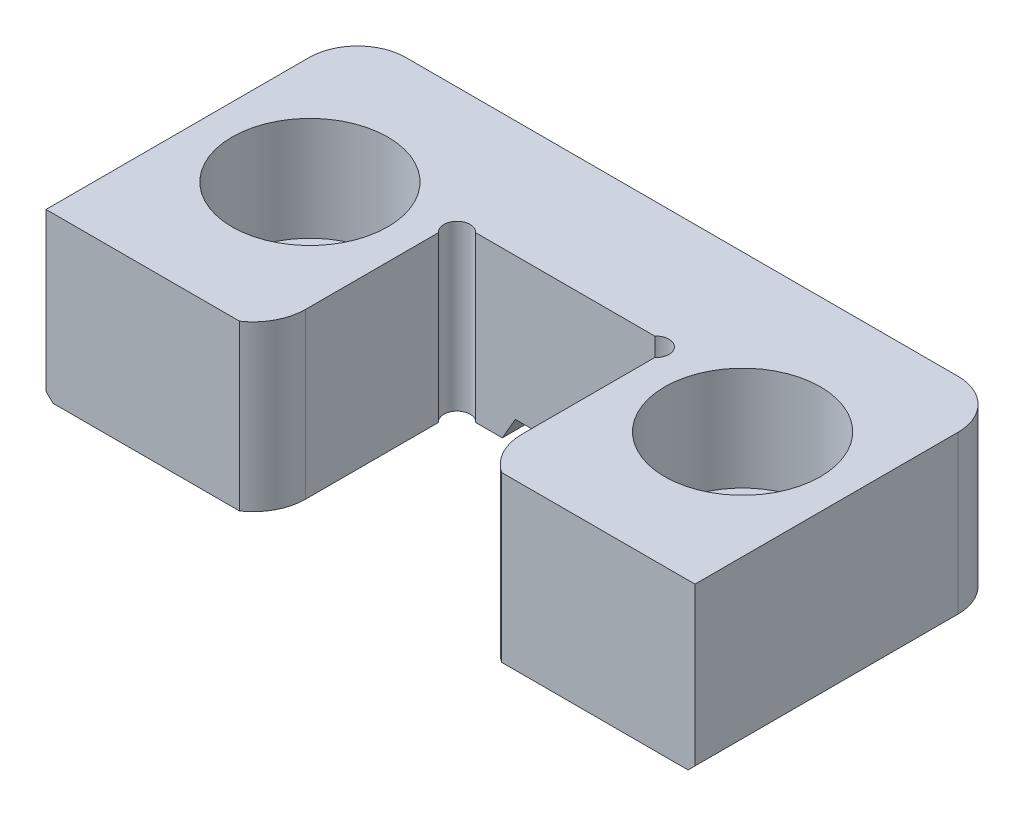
SolidWorks part; units mm, degrees
ref_plane "Front Plane" through (0, 0, 0) normal (0, 0, 1) x (1, 0, 0)
ref_plane "Top Plane" through (0, 0, 0) normal (0, 1, 0) x (1, 0, 0)
ref_plane "Right Plane" through (0, 0, 0) normal (1, 0, 0) x (0, 0, -1)
sketch "Sketch1" plane through (0, 0, 0) normal (0, 1, 0) x (1, 0, 0)
  line L0 (0, 0) -> (0, 50000) construction
  line L1 (0, 0) -> (50000, 0) construction
  line L2 (12.499, 0) -> (37.5, 0)
  line L3 (-37.5, 0) -> (-12.499, 0)
  line L4 (-37.5, 0) -> (-37.5, 36)
  line L5 (-37.5, 36) -> (37.5, 36)
  line L6 (37.5, 0) -> (37.5, 36)
  line L8 (-12.499, 0) -> (-12.499, 22.5)
  line L9 (-12.499, 22.5) -> (12.499, 22.5)
  line L10 (12.499, 0) -> (12.499, 22.5)
  dimension "D1" = 36
  dimension "D2" = 75
  dimension "D3" = 24.998
  dimension "D4" = 22.5
extrude "Boss-Extrude1" add sketch "Sketch1" against normal blind 19 separate body
fillet "Fillet1" radius 5.6 2 edges at (37.5, -9.5, -36) (-37.5, -9.5, -36)
sketch "Sketch2" plane through (0, 0, 0) normal (0, 1, 0) x (1, 0, 0)
  line L0 (0, 0) -> (0, 50000) construction
  line L1 (-12.499, 0) -> (-12.499, 22.5) construction
  line L2 (-37.5, 0) -> (-12.499, 0) construction
  line L3 (-12.499, 5) -> (-12.499, 12.7)
  line L4 (-25.199, 0) -> (-15.1403, 0)
  line L5 (25.199, 0) -> (25.199, -25.4)
  line L6 (-25.199, -25.4) -> (25.199, -25.4)
  line L7 (-12.499, 12.7) -> (12.499, 12.7)
  line L8 (-25.199, 0) -> (-25.199, -25.4)
  line L9 (25.199, 0) -> (15.1403, 0)
  line L10 (12.499, 5) -> (12.499, 12.7)
  arc A0 (-12.9393, 1.6848) -> (-15.1403, 0) centre (-15.1403, 2.28) cw construction
  arc A1 (12.9393, 1.6848) -> (12.499, 5) centre (25.199, 5) cw construction
  arc A2 (-12.9393, 1.6848) -> (-12.499, 5) centre (-25.199, 5) ccw construction
  arc A3 (12.9393, 1.6848) -> (15.1403, 0) centre (15.1403, 2.28) ccw construction
  arc A4 (15.1403, 0) -> (12.499, 5) centre (18.5522, 5) cw
  arc A5 (-15.1403, 0) -> (-12.499, 5) centre (-18.5522, 5) ccw
  point P14 (0, -25.4)
  point P24 (0, 12.7)
  dimension "D1" = 2.28
  dimension "D2" = 12.7
  dimension "D3" = 5
  dimension "D4" = 12.7
  dimension "D5" = 25.4
extrude "Cut-Extrude1" cut sketch "Sketch2" against normal through all
sketch "Sketch3" plane through (0, 0, 0) normal (0, 1, 0) x (1, 0, 0)
  line L2 (-13.009, 5) -> (-13.009, 22.5)
  line L3 (-13.009, 5) -> (-13.009, 22.5) construction
  line L4 (0, 0) -> (0, 50000) construction
  line L5 (-12.499, 23.01) -> (12.499, 23.01)
  line L6 (-12.499, 23.01) -> (12.499, 23.01) construction
  circle A0 centre (-11.489, 21.49) radius 1.52
  circle A1 centre (11.489, 21.49) radius 1.52
  dimension "D3" = 1.52
  dimension "D1" = 0.51
  dimension "D2" = 0.51
extrude "Cut-Extrude2" cut sketch "Sketch3" against normal through all
sketch "Sketch5" plane through (0, 0, -36) normal (0, 0, -1) x (-1, 0, 0)
  line L0 (-6.35, -17.41) -> (6.35, -17.41)
  line L1 (-31.9, 0) -> (31.9, 0) construction
  line L2 (0, 0) -> (0, 50000) construction
  line L3 (6.35, -17.41) -> (7.268, -19)
  line L4 (-31.9, -19) -> (31.9, -19) construction
  line L5 (-7.268, -19) -> (7.268, -19)
  line L6 (-6.35, -17.41) -> (-7.268, -19)
  point P4 (0, 0)
  point P12 (0, -19)
  point P13 (0, -17.41)
  dimension "D1" = 30
  dimension "D2" = 1.59
  dimension "D3" = 12.7
extrude "Cut-Extrude3" cut sketch "Sketch5" against normal through all
chamfer "Chamfer5" distance 3.8 angle 15 1 edges at (0, -17.41, -22.5)
hole_wizard "CBORE for M10 SHCS1" positions "Sketch7" profile "Sketch6" counterbore size "M10" standard "Ansi Metric"
sketch "Sketch7" plane through (0, 0, 0) normal (0, 1, 0) x (-1, 0, 0)
  line L0 (0, 0) -> (0, 50000) construction
  line L1 (-31.9, -36) -> (31.9, -36) construction
  line L2 (-37.5, 0) -> (-37.5, -30.4) construction
  point P0 (-25, -18)
  point P7 (25, -18)
  dimension "D1" = 18
  dimension "D2" = 12.5
sketch "Sketch6" plane through (25, 0, -18) normal (1, 0, 0) x (0, 0, 1)
  line L0 (0, 0) -> (0, 19)
  line L1 (0, 19) -> (5.5, 19)
  line L3 (5.5, 19) -> (5.5, 12)
  line L4 (5.5, 12) -> (9, 12)
  line L5 (9, 12) -> (9, 0)
  line L7 (9, 0) -> (0, 0)
  line L11 (0, -6.35) -> (0, 107.95) construction
  dimension "Thru Hole Dia." = 11
  dimension "Thru Hole Depth" = 19
  dimension "C'Bore Dia." = 18
  dimension "C'Bore Depth" = 12
chamfer "Chamfer6" distance 0.8 angle 45 6 edges at (-19.584, -19, -36) (-35.8598, -19, -34.3598) (-37.5, -19, -15.2) (19.584, -19, -36) (35.8598, -19, -34.3598) (37.5, -19, -15.2)
